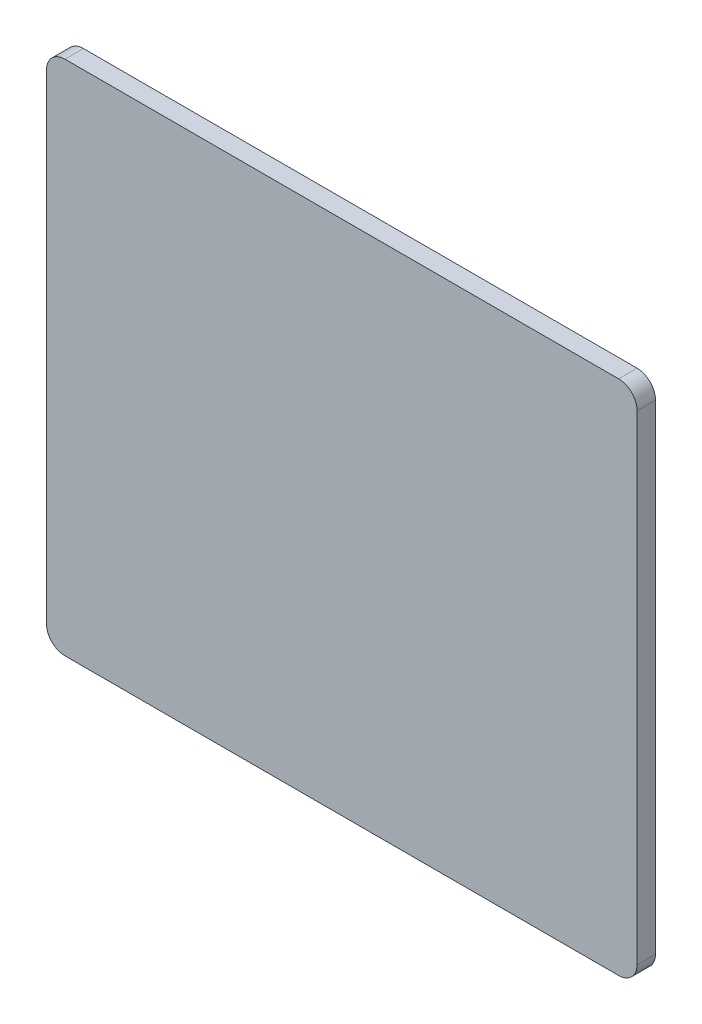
SolidWorks part; units mm, degrees
ref_plane "Plan de face" through (0, 0, 0) normal (0, 0, 1) x (1, 0, 0)
ref_plane "Plan de dessus" through (0, 0, 0) normal (0, 1, 0) x (1, 0, 0)
ref_plane "Plan de droite" through (0, 0, 0) normal (1, 0, 0) x (0, 0, -1)
sketch "Esquisse1" plane through (0, 0, 0) normal (0, 0, 1) x (1, 0, 0)
  line L1 (1, 28) -> (31, 28)
  line L2 (0, 27) -> (0, 1)
  line L3 (1, 0) -> (31, 0)
  line L4 (32, 27) -> (32, 1)
  arc A0 (0, 1) -> (1, 0) centre (1, 1) ccw
  arc A1 (31, 28) -> (32, 27) centre (31, 27) cw
  arc A2 (1, 28) -> (0, 27) centre (1, 27) ccw
  arc A3 (31, 0) -> (32, 1) centre (31, 1) ccw
  point P7 (0, 0)
  point P10 (32, 28)
  point P13 (0, 28)
  point P16 (32, 0)
  dimension "D3" = 1
  dimension "D1" = 32
  dimension "D2" = 28
extrude "Extrusion1" add sketch "Esquisse1" along normal blind 1
